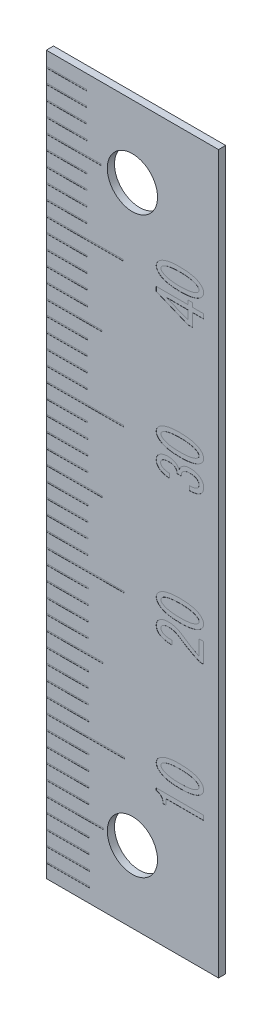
SolidWorks part; units mm, degrees
ref_plane "Front" through (0, 0, 0) normal (0, 0, 1) x (1, 0, 0)
ref_plane "Top" through (0, 0, 0) normal (0, 1, 0) x (1, 0, 0)
ref_plane "Right" through (0, 0, 0) normal (1, 0, 0) x (0, 0, -1)
sketch "Sketch1" plane through (0, 0, 0) normal (0, 0, 1) x (1, 0, 0)
  line L1 (0, 0) -> (0, 50)
  line L2 (0, 0) -> (12, 0)
  line L3 (12, 0) -> (12, 50)
  line L4 (0, 50) -> (12, 50)
  dimension "D1" = 50
  dimension "D2" = 12
extrude "Extrude1" add sketch "Sketch1" along normal blind 0.5
sketch "Sketch2" plane through (0, 0, 0.5) normal (0, 0, 1) x (1, 0, 0)
  line L0 (0, 50) -> (0, 0) construction
  line L1 (0, 0) -> (12, 0) construction
  line L2 (12, 50) -> (0, 50) construction
  circle A0 centre (6, 5) radius 1.75
  circle A1 centre (6, 45) radius 1.75
  dimension "D1" = 6
  dimension "D2" = 6
  dimension "D3" = 5
  dimension "D4" = 5
  dimension "D5" = 3.5
  dimension "D6" = 3.5
extrude "Extrude2" cut sketch "Sketch2" against normal through all
sketch "Sketch3" plane through (0, 0, 0.5) normal (0, 0, 1) x (1, 0, 0)
  line L0 (12, 50) -> (0, 50) construction
  line L1 (7.5, 38.25) -> (11, 38.25) construction
  line L2 (7.5, 38.25) -> (7.5, 41.75) construction
  line L3 (7.5, 41.75) -> (11, 41.75) construction
  line L4 (11, 38.25) -> (11, 41.75) construction
  line L6 (11, 28.25) -> (11, 31.75) construction
  line L7 (11, 18.25) -> (11, 21.75) construction
  line L8 (11, 8.25) -> (11, 11.75) construction
  line L9 (12, 0) -> (12, 50) construction
  text T0 "40" font "ＭＳ ゴシック" height in points 11
  text T1 "30  " font "ＭＳ ゴシック" height in points 11
  text T2 "20" font "ＭＳ ゴシック" height in points 11
  text T3 "10" font "ＭＳ ゴシック" height in points 11
  point P4 (11, 40)
  dimension "D1" = 3.5
  dimension "D2" = 10
  dimension "D3" = 1
  dimension "D4" = 3.5
  dimension "D5" = 4
extrude "Extrude3" cut sketch "Sketch3" against normal blind 0.01
sketch "Sketch4" plane through (0, 0, 0.5) normal (0, 0, 1) x (1, 0, 0)
  line L166 (5.9027, 49.8047) -> (6, 0) construction
  line L167 (0, 0) -> (12, 0) construction
  line L168 (2.9959, 1.0383) -> (2.9963, 0.9383)
  line L169 (-0.0037, 0.9265) -> (2.9963, 0.9383)
  line L210 (-0.0041, 1.0265) -> (2.9959, 1.0383)
  line L211 (-0.0041, 1.0265) -> (-0.0037, 0.9265)
  line L212 (2.992, 2.0383) -> (2.9924, 1.9383)
  line L213 (-0.0076, 1.9265) -> (2.9924, 1.9383)
  line L214 (-0.008, 2.0265) -> (2.992, 2.0383)
  line L215 (-0.008, 2.0265) -> (-0.0076, 1.9265)
  line L216 (2.9881, 3.0383) -> (2.9885, 2.9383)
  line L217 (-0.0115, 2.9265) -> (2.9885, 2.9383)
  line L218 (-0.0119, 3.0265) -> (2.9881, 3.0383)
  line L219 (-0.0119, 3.0265) -> (-0.0115, 2.9265)
  line L220 (2.9842, 4.0382) -> (2.9846, 3.9382)
  line L221 (-0.0154, 3.9265) -> (2.9846, 3.9382)
  line L222 (-0.0158, 4.0265) -> (2.9842, 4.0382)
  line L223 (-0.0158, 4.0265) -> (-0.0154, 3.9265)
  line L224 (2.9764, 6.0382) -> (2.9768, 5.9382)
  line L225 (-0.0232, 5.9265) -> (2.9768, 5.9382)
  line L226 (-0.0236, 6.0265) -> (2.9764, 6.0382)
  line L227 (-0.0236, 6.0265) -> (-0.0232, 5.9265)
  line L228 (2.9725, 7.0382) -> (2.9729, 6.9382)
  line L229 (-0.0271, 6.9265) -> (2.9729, 6.9382)
  line L230 (-0.0275, 7.0265) -> (2.9725, 7.0382)
  line L231 (-0.0275, 7.0265) -> (-0.0271, 6.9265)
  line L232 (2.9686, 8.0382) -> (2.969, 7.9382)
  line L233 (-0.031, 7.9265) -> (2.969, 7.9382)
  line L234 (-0.0314, 8.0265) -> (2.9686, 8.0382)
  line L235 (2.9647, 9.0382) -> (2.9651, 8.9382)
  line L236 (-0.0349, 8.9265) -> (2.9651, 8.9382)
  line L237 (-0.0353, 9.0265) -> (-0.0349, 8.9265)
  line L238 (-0.0353, 9.0265) -> (2.9647, 9.0382)
  line L239 (3.9807, 4.9421) -> (3.9803, 5.0421)
  line L240 (-0.0197, 5.0265) -> (3.9803, 5.0421)
  line L241 (-0.0193, 4.9265) -> (-0.0197, 5.0265)
  line L242 (-0.0193, 4.9265) -> (3.9807, 4.9421)
  line L243 (-0.0314, 8.0265) -> (-0.031, 7.9265)
  line L244 (2.9568, 11.0382) -> (2.9572, 10.9382)
  line L245 (-0.0427, 10.9265) -> (2.9572, 10.9382)
  line L246 (-0.0431, 11.0265) -> (2.9568, 11.0382)
  line L247 (-0.0431, 11.0265) -> (-0.0427, 10.9265)
  line L248 (2.9529, 12.0382) -> (2.9533, 11.9382)
  line L249 (-0.0466, 11.9265) -> (2.9533, 11.9382)
  line L250 (-0.047, 12.0265) -> (2.9529, 12.0382)
  line L251 (-0.047, 12.0265) -> (-0.0466, 11.9265)
  line L252 (2.949, 13.0382) -> (2.9494, 12.9382)
  line L253 (-0.0506, 12.9265) -> (2.9494, 12.9382)
  line L254 (-0.0509, 13.0265) -> (2.949, 13.0382)
  line L255 (-0.0509, 13.0265) -> (-0.0506, 12.9265)
  line L256 (2.9451, 14.0382) -> (2.9455, 13.9382)
  line L257 (-0.0545, 13.9264) -> (2.9455, 13.9382)
  line L258 (-0.0549, 14.0264) -> (2.9451, 14.0382)
  line L259 (-0.0549, 14.0264) -> (-0.0545, 13.9264)
  line L260 (2.9373, 16.0382) -> (2.9377, 15.9382)
  line L261 (-0.0623, 15.9264) -> (2.9377, 15.9382)
  line L262 (-0.0627, 16.0264) -> (2.9373, 16.0382)
  line L263 (-0.0627, 16.0264) -> (-0.0623, 15.9264)
  line L264 (2.9334, 17.0381) -> (2.9338, 16.9381)
  line L265 (-0.0662, 16.9264) -> (2.9338, 16.9381)
  line L266 (-0.0666, 17.0264) -> (2.9334, 17.0381)
  line L267 (-0.0666, 17.0264) -> (-0.0662, 16.9264)
  line L268 (2.9295, 18.0381) -> (2.9299, 17.9381)
  line L269 (-0.0701, 17.9264) -> (2.9299, 17.9381)
  line L270 (-0.0705, 18.0264) -> (2.9295, 18.0381)
  line L271 (2.9256, 19.0381) -> (2.926, 18.9381)
  line L272 (-0.074, 18.9264) -> (2.926, 18.9381)
  line L273 (-0.0744, 19.0264) -> (-0.074, 18.9264)
  line L274 (-0.0744, 19.0264) -> (2.9256, 19.0381)
  line L275 (3.9416, 14.9421) -> (3.9412, 15.0421)
  line L276 (-0.0588, 15.0264) -> (3.9412, 15.0421)
  line L277 (-0.0584, 14.9264) -> (-0.0588, 15.0264)
  line L278 (-0.0584, 14.9264) -> (3.9416, 14.9421)
  line L279 (-0.0705, 18.0264) -> (-0.0701, 17.9264)
  line L280 (-0.0388, 9.9265) -> (-0.0392, 10.0265)
  line L281 (5.4611, 9.948) -> (-0.0388, 9.9265)
  line L282 (5.4607, 10.048) -> (5.4611, 9.948)
  line L283 (-0.0392, 10.0265) -> (5.4607, 10.048)
  line L284 (2.9178, 21.0381) -> (2.9182, 20.9381)
  line L285 (-0.0818, 20.9264) -> (2.9182, 20.9381)
  line L286 (-0.0822, 21.0264) -> (2.9178, 21.0381)
  line L287 (-0.0822, 21.0264) -> (-0.0818, 20.9264)
  line L288 (2.9139, 22.0381) -> (2.9143, 21.9381)
  line L289 (-0.0857, 21.9264) -> (2.9143, 21.9381)
  line L290 (-0.0861, 22.0264) -> (2.9139, 22.0381)
  line L291 (-0.0861, 22.0264) -> (-0.0857, 21.9264)
  line L292 (2.91, 23.0381) -> (2.9104, 22.9381)
  line L293 (-0.0896, 22.9264) -> (2.9104, 22.9381)
  line L294 (-0.09, 23.0264) -> (2.91, 23.0381)
  line L295 (-0.09, 23.0264) -> (-0.0896, 22.9264)
  line L296 (2.9061, 24.0381) -> (2.9064, 23.9381)
  line L297 (-0.0935, 23.9264) -> (2.9064, 23.9381)
  line L298 (-0.0939, 24.0264) -> (2.9061, 24.0381)
  line L299 (-0.0939, 24.0264) -> (-0.0935, 23.9264)
  line L300 (2.8982, 26.0381) -> (2.8986, 25.9381)
  line L301 (-0.1013, 25.9264) -> (2.8986, 25.9381)
  line L302 (-0.1017, 26.0264) -> (2.8982, 26.0381)
  line L303 (-0.1017, 26.0264) -> (-0.1013, 25.9264)
  line L304 (2.8943, 27.0381) -> (2.8947, 26.9381)
  line L305 (-0.1053, 26.9264) -> (2.8947, 26.9381)
  line L306 (-0.1056, 27.0263) -> (2.8943, 27.0381)
  line L307 (-0.1056, 27.0263) -> (-0.1053, 26.9264)
  line L308 (2.8904, 28.0381) -> (2.8908, 27.9381)
  line L309 (-0.1092, 27.9263) -> (2.8908, 27.9381)
  line L310 (-0.1096, 28.0263) -> (2.8904, 28.0381)
  line L311 (2.8865, 29.0381) -> (2.8869, 28.9381)
  line L312 (-0.1131, 28.9263) -> (2.8869, 28.9381)
  line L313 (-0.1135, 29.0263) -> (-0.1131, 28.9263)
  line L314 (-0.1135, 29.0263) -> (2.8865, 29.0381)
  line L315 (3.9025, 24.942) -> (3.9021, 25.042)
  line L316 (-0.0978, 25.0264) -> (3.9021, 25.042)
  line L317 (-0.0974, 24.9264) -> (-0.0978, 25.0264)
  line L318 (-0.0974, 24.9264) -> (3.9025, 24.942)
  line L319 (-0.1096, 28.0263) -> (-0.1092, 27.9263)
  line L320 (-0.0779, 19.9264) -> (-0.0783, 20.0264)
  line L321 (5.4221, 19.9479) -> (-0.0779, 19.9264)
  line L322 (5.4217, 20.0479) -> (5.4221, 19.9479)
  line L323 (-0.0783, 20.0264) -> (5.4217, 20.0479)
  line L324 (2.8787, 31.038) -> (2.8791, 30.938)
  line L325 (-0.1209, 30.9263) -> (2.8791, 30.938)
  line L326 (-0.1213, 31.0263) -> (2.8787, 31.038)
  line L327 (-0.1213, 31.0263) -> (-0.1209, 30.9263)
  line L328 (2.8748, 32.038) -> (2.8752, 31.938)
  line L329 (-0.1248, 31.9263) -> (2.8752, 31.938)
  line L330 (-0.1252, 32.0263) -> (2.8748, 32.038)
  line L331 (-0.1252, 32.0263) -> (-0.1248, 31.9263)
  line L332 (2.8709, 33.038) -> (2.8713, 32.938)
  line L333 (-0.1287, 32.9263) -> (2.8713, 32.938)
  line L334 (-0.1291, 33.0263) -> (2.8709, 33.038)
  line L335 (-0.1291, 33.0263) -> (-0.1287, 32.9263)
  line L336 (2.867, 34.038) -> (2.8674, 33.938)
  line L337 (-0.1326, 33.9263) -> (2.8674, 33.938)
  line L338 (-0.133, 34.0263) -> (2.867, 34.038)
  line L339 (-0.133, 34.0263) -> (-0.1326, 33.9263)
  line L340 (2.8592, 36.038) -> (2.8596, 35.938)
  line L341 (-0.1404, 35.9263) -> (2.8596, 35.938)
  line L342 (-0.1408, 36.0263) -> (2.8592, 36.038)
  line L343 (-0.1408, 36.0263) -> (-0.1404, 35.9263)
  line L344 (2.8553, 37.038) -> (2.8556, 36.938)
  line L345 (-0.1443, 36.9263) -> (2.8556, 36.938)
  line L346 (-0.1447, 37.0263) -> (2.8553, 37.038)
  line L347 (-0.1447, 37.0263) -> (-0.1443, 36.9263)
  line L348 (2.8513, 38.038) -> (2.8517, 37.938)
  line L349 (-0.1482, 37.9263) -> (2.8517, 37.938)
  line L350 (-0.1486, 38.0263) -> (2.8513, 38.038)
  line L351 (2.8474, 39.038) -> (2.8478, 38.938)
  line L352 (-0.1521, 38.9263) -> (2.8478, 38.938)
  line L353 (-0.1525, 39.0263) -> (-0.1521, 38.9263)
  line L354 (-0.1525, 39.0263) -> (2.8474, 39.038)
  line L355 (3.8635, 34.9419) -> (3.8631, 35.0419)
  line L356 (-0.1369, 35.0263) -> (3.8631, 35.0419)
  line L357 (-0.1365, 34.9263) -> (-0.1369, 35.0263)
  line L358 (-0.1365, 34.9263) -> (3.8635, 34.9419)
  line L359 (-0.1486, 38.0263) -> (-0.1482, 37.9263)
  line L360 (2.8396, 41.038) -> (2.84, 40.938)
  line L361 (-0.16, 40.9262) -> (2.84, 40.938)
  line L362 (-0.1603, 41.0262) -> (2.8396, 41.038)
  line L363 (-0.1603, 41.0262) -> (-0.16, 40.9262)
  line L364 (2.8357, 42.038) -> (2.8361, 41.938)
  line L365 (-0.1639, 41.9262) -> (2.8361, 41.938)
  line L366 (-0.1643, 42.0262) -> (2.8357, 42.038)
  line L367 (-0.1643, 42.0262) -> (-0.1639, 41.9262)
  line L368 (2.8318, 43.0379) -> (2.8322, 42.938)
  line L369 (-0.1678, 42.9262) -> (2.8322, 42.938)
  line L370 (-0.1682, 43.0262) -> (2.8318, 43.0379)
  line L371 (-0.1682, 43.0262) -> (-0.1678, 42.9262)
  line L372 (2.8279, 44.0379) -> (2.8283, 43.9379)
  line L373 (-0.1717, 43.9262) -> (2.8283, 43.9379)
  line L374 (-0.1721, 44.0262) -> (2.8279, 44.0379)
  line L375 (-0.1721, 44.0262) -> (-0.1717, 43.9262)
  line L376 (-0.117, 29.9263) -> (-0.1174, 30.0263)
  line L377 (5.383, 29.9478) -> (-0.117, 29.9263)
  line L378 (5.3826, 30.0478) -> (5.383, 29.9478)
  line L379 (-0.1174, 30.0263) -> (5.3826, 30.0478)
  line L380 (2.8201, 46.0379) -> (2.8205, 45.9379)
  line L381 (-0.1795, 45.9262) -> (2.8205, 45.9379)
  line L382 (-0.1799, 46.0262) -> (2.8201, 46.0379)
  line L383 (-0.1799, 46.0262) -> (-0.1795, 45.9262)
  line L384 (2.8162, 47.0379) -> (2.8166, 46.9379)
  line L385 (-0.1834, 46.9262) -> (2.8166, 46.9379)
  line L386 (-0.1838, 47.0262) -> (2.8162, 47.0379)
  line L387 (-0.1838, 47.0262) -> (-0.1834, 46.9262)
  line L388 (2.8123, 48.0379) -> (2.8127, 47.9379)
  line L389 (-0.1873, 47.9262) -> (2.8127, 47.9379)
  line L390 (-0.1877, 48.0262) -> (2.8123, 48.0379)
  line L391 (2.8084, 49.0379) -> (2.8088, 48.9379)
  line L392 (-0.1912, 48.9262) -> (2.8088, 48.9379)
  line L393 (-0.1916, 49.0262) -> (-0.1912, 48.9262)
  line L394 (-0.1916, 49.0262) -> (2.8084, 49.0379)
  line L395 (3.8244, 44.9418) -> (3.824, 45.0418)
  line L396 (-0.176, 45.0262) -> (3.824, 45.0418)
  line L397 (-0.1756, 44.9262) -> (-0.176, 45.0262)
  line L398 (-0.1756, 44.9262) -> (3.8244, 44.9418)
  line L399 (-0.1877, 48.0262) -> (-0.1873, 47.9262)
  line L400 (-0.1561, 39.9263) -> (-0.1564, 40.0263)
  line L401 (5.3439, 39.9477) -> (-0.1561, 39.9263)
  line L402 (5.3435, 40.0477) -> (5.3439, 39.9477)
  line L403 (-0.1564, 40.0263) -> (5.3435, 40.0477)
extrude "Extrude4" cut sketch "Sketch4" against normal blind 0.01
move or copy body "Body-Move/Copy2" bodies to move or copy 105 copy no translate (-12, 0, 0)
